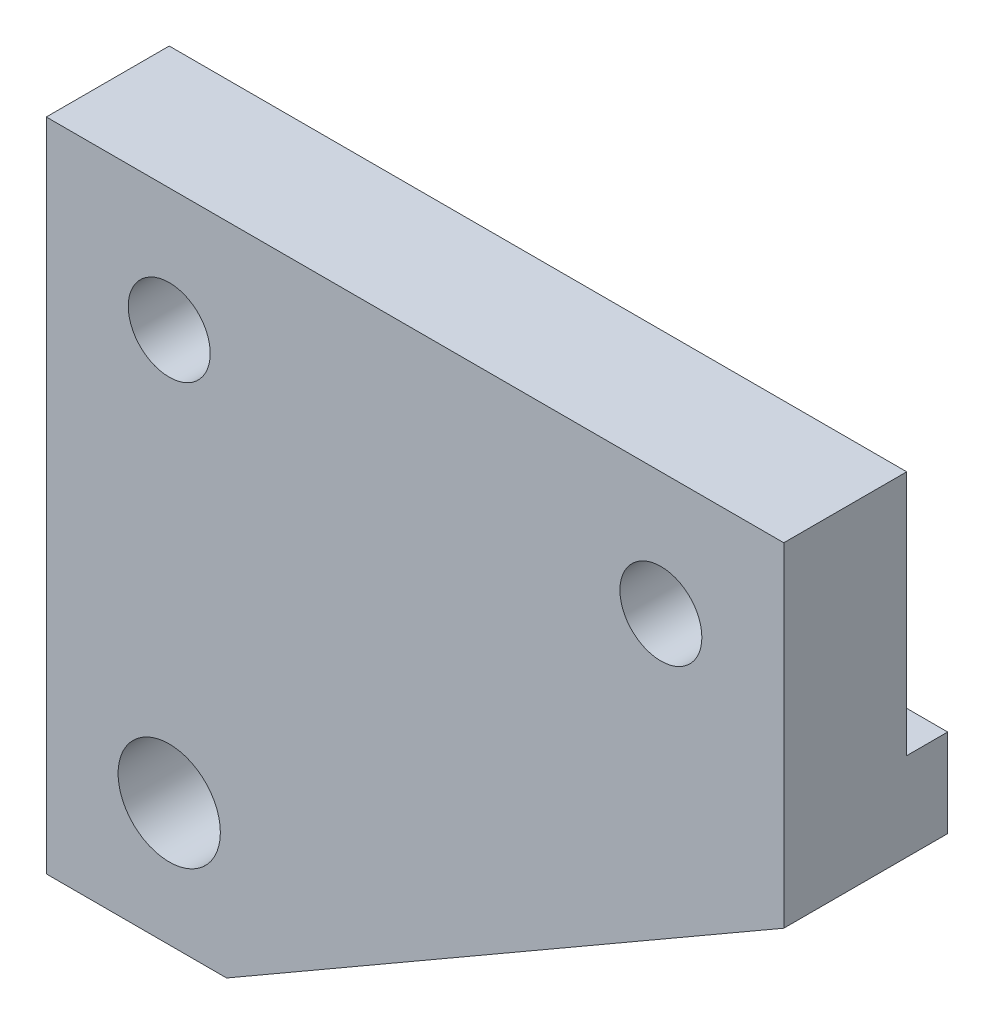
SolidWorks part; units mm, degrees
ref_plane "Front Plane" through (0, 0, 0) normal (0, 0, 1) x (1, 0, 0)
ref_plane "Top Plane" through (0, 0, 0) normal (0, 1, 0) x (1, 0, 0)
ref_plane "Right Plane" through (0, 0, 0) normal (1, 0, 0) x (0, 0, -1)
sketch "Sketch1" plane through (0, 0, 0) normal (0, 0, 1) x (1, 0, 0)
  line L0 (0, 0) -> (28.575, 0)
  line L1 (28.575, 0) -> (28.575, -50.8)
  line L2 (28.575, -50.8) -> (-28.575, -50.8)
  line L3 (-28.575, -50.8) -> (-28.575, 0)
  line L4 (-28.575, 0) -> (0, 0)
  line L5 (0, 0) -> (0, 19.2534) construction
  line L6 (-28.575, -19.05) -> (28.575, -19.05)
  line L7 (-28.575, -28.575) -> (28.575, -28.575)
  circle A0 centre (-19.05, -9.525) radius 3.175
  circle A1 centre (19.05, -9.525) radius 3.175
  circle A2 centre (-19.05, -41.275) radius 3.9624
  dimension "D4" = 6.35
  dimension "D7" = 7.9248
  dimension "D1" = 9.525
  dimension "D2" = 57.15
  dimension "D3" = 9.525
  dimension "D5" = 38.1
  dimension "D6" = 50.8
  dimension "D8" = 41.275
  dimension "D9" = 19.05
  dimension "D10" = 22.225
sketch "Sketch2" plane through (0, 0, 0) normal (0, 0, 1) x (1, 0, 0)
  line L0 (28.575, -50.8) -> (-28.575, -50.8) construction
  line L1 (-28.575, -50.8) -> (-28.575, 0) construction
  line L2 (-28.575, 0) -> (0, 0) construction
  line L3 (0, 0) -> (28.575, 0) construction
  line L4 (28.575, 0) -> (28.575, -50.8) construction
  line L5 (28.575, -50.8) -> (-28.575, -50.8)
  line L6 (-28.575, -50.8) -> (-28.575, 0)
  line L7 (-28.575, 0) -> (0, 0)
  line L8 (0, 0) -> (28.575, 0)
  line L9 (28.575, 0) -> (28.575, -50.8)
  circle A0 centre (-19.05, -9.525) radius 3.175 construction
  circle A1 centre (19.05, -9.525) radius 3.175 construction
  circle A2 centre (-19.05, -41.275) radius 3.9624 construction
  circle A3 centre (-19.05, -9.525) radius 3.175
  circle A4 centre (19.05, -9.525) radius 3.175
  circle A5 centre (-19.05, -41.275) radius 3.9624
extrude "Boss-Extrude1" add sketch "Sketch2" along normal blind 12.7
sketch "Sketch4" plane through (0, 0, 0) normal (0, 0, 1) x (1, 0, 0)
  line L0 (-28.575, -19.05) -> (28.575, -19.05) construction
  line L1 (28.575, 0) -> (28.575, -50.8) construction
  line L2 (0, 0) -> (28.575, 0) construction
  line L3 (-28.575, 0) -> (0, 0) construction
  line L4 (-28.575, -50.8) -> (-28.575, 0) construction
  line L5 (-28.575, -19.05) -> (28.575, -19.05)
  line L6 (28.575, 0) -> (28.575, -19.05)
  line L7 (0, 0) -> (28.575, 0)
  line L8 (-28.575, 0) -> (0, 0)
  line L9 (-28.575, -19.05) -> (-28.575, 0)
extrude "Cut-Extrude2" cut sketch "Sketch4" along normal blind 3.175
chamfer "Chamfer1" distance 43.18 angle 30 1 edges at (28.575, -50.8, 6.35)
